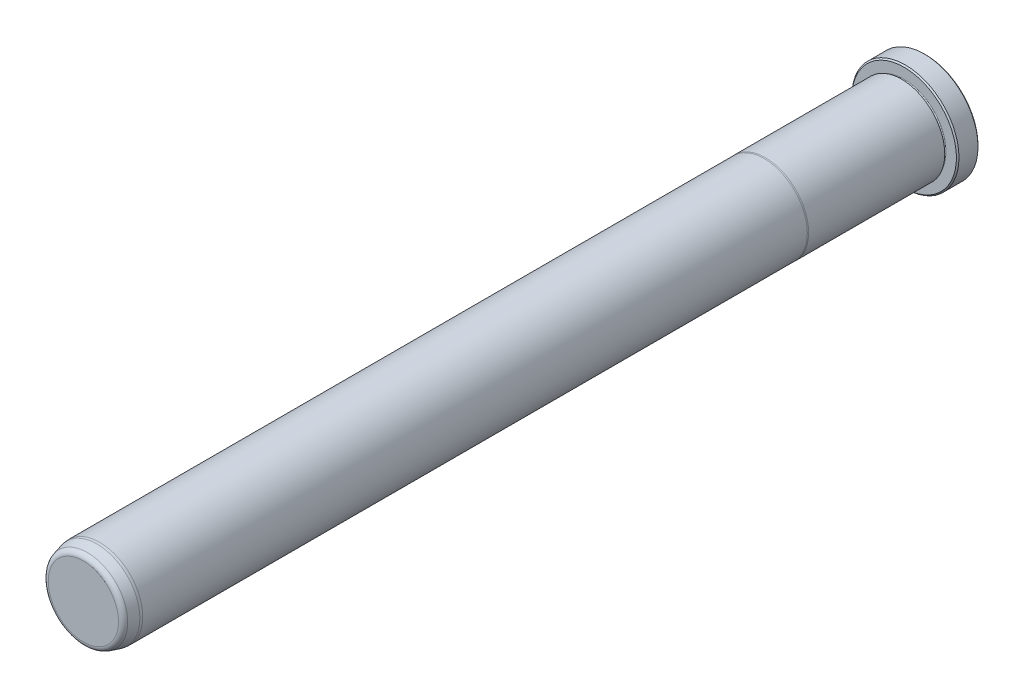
SolidWorks part; units mm, degrees
ref_plane "Front Plane" through (0, 0, 0) normal (0, 0, 1) x (1, 0, 0)
ref_plane "Top Plane" through (0, 0, 0) normal (0, 1, 0) x (1, 0, 0)
ref_plane "Right Plane" through (0, 0, 0) normal (1, 0, 0) x (0, 0, -1)
sketch "Sketch1" plane through (0, 0, 0) normal (1, 0, 0) x (0, 0, -1)
  line L0 (0, 0) -> (0, 15.748)
  line L1 (0, 15.748) -> (-6.35, 15.748)
  line L2 (-6.35, 15.748) -> (-6.35, 12.3063)
  line L3 (-6.35, 11.9253) -> (-7.112, 11.9253) construction
  line L4 (-7.112, 12.3063) -> (-7.112, 12.7127)
  line L5 (-7.112, 12.7127) -> (-47.1348, 12.7127)
  line L6 (-47.1348, 12.7127) -> (-47.498, 12.6873)
  line L7 (-47.498, 12.6873) -> (-242.8875, 12.6873)
  line L9 (-247.65, 11.5487) -> (-247.65, 0)
  line L10 (-247.65, 0) -> (0, 0)
  line L11 (0, 0) -> (13.6287, 0) construction
  line L12 (-242.8875, 12.6873) -> (-243.6495, 12.6206)
  line L13 (-243.6495, 12.6206) -> (-247.65, 11.5487)
  arc A0 (-7.112, 12.3063) -> (-6.35, 12.3063) centre (-6.731, 12.3063) ccw
  dimension "D14" = 0.762
  dimension "D1" = 6.35
  dimension "D2" = 0.762
  dimension "D3" = 31.496
  dimension "D4" = 25.4254
  dimension "D5" = 47.498
  dimension "D6" = 247.65
  dimension "D7" = 0.7874
  dimension "D8" = 4
  dimension "D9" = 25.3746
  dimension "D10" = 5
  dimension "D11" = 15
  dimension "D12" = 0.762
  dimension "D13" = 4.7625
revolve "Revolve1" add sketch "Sketch1" angle 360 about L11
fillet "Fillet6" radius 1.5875 1 edges at (11.5487, 0, 247.65)
chamfer "Chamfer1" distance 0.381 angle 45 2 edges at (15.748, 0, 0) (15.748, 0, 6.35)
